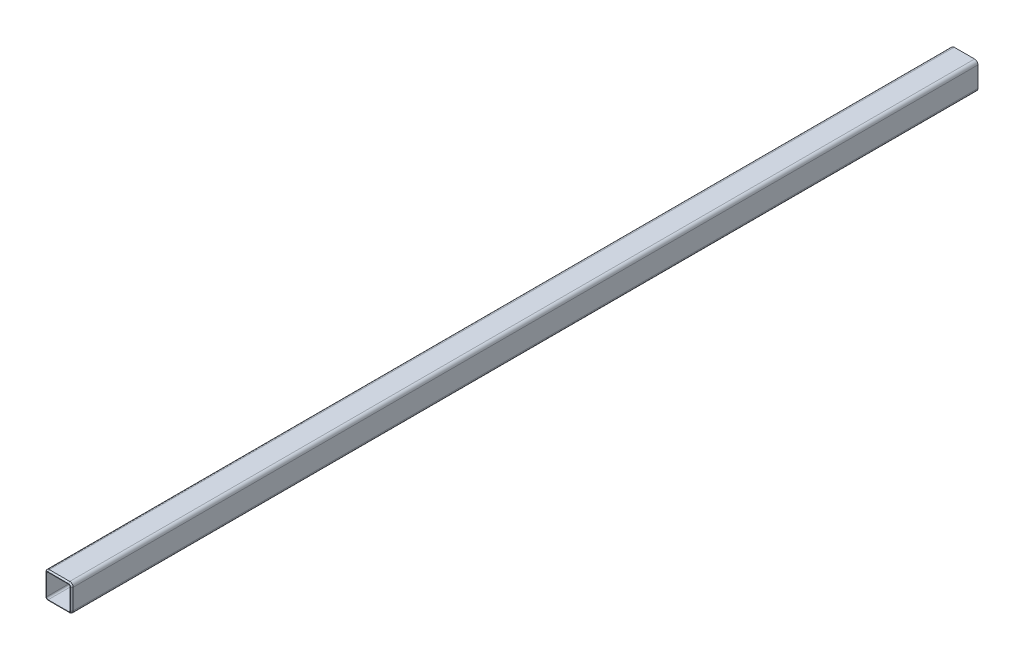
SolidWorks part; units mm, degrees
ref_plane "Front Plane" through (0, 0, 0) normal (1, 0, 0) x (0, 1, 0)
ref_plane "Top Plane" through (0, 0, 0) normal (0, 0, 1) x (0, 1, 0)
ref_plane "Right Plane" through (0, 0, 0) normal (0, 1, 0) x (-1, 0, 0)
sketch "8in beam" plane through (0, 0, 0) normal (0, 0, 1) x (0, 1, 0)
  line B0 (-76.2, -88.9) -> (76.2, -88.9)
  line B1 (-88.9, -76.2) -> (-88.9, 76.2)
  line B2 (76.2, 88.9) -> (-76.2, 88.9)
  line B3 (88.9, 76.2) -> (88.9, -76.2)
  line B4 (-76.2, -101.6) -> (76.2, -101.6)
  line B5 (-101.6, -76.2) -> (-101.6, 76.2)
  line B6 (76.2, 101.6) -> (-76.2, 101.6)
  line B7 (101.6, 76.2) -> (101.6, -76.2)
  arc B8 (101.6, 76.2) -> (76.2, 101.6) centre (76.2, 76.2) ccw
  arc B9 (76.2, -101.6) -> (101.6, -76.2) centre (76.2, -76.2) ccw
  arc B10 (-101.6, -76.2) -> (-76.2, -101.6) centre (-76.2, -76.2) ccw
  arc B11 (-76.2, 101.6) -> (-101.6, 76.2) centre (-76.2, 76.2) ccw
  arc B12 (-76.2, 88.9) -> (-88.9, 76.2) centre (-76.2, 76.2) ccw
  arc B13 (88.9, 76.2) -> (76.2, 88.9) centre (76.2, 76.2) ccw
  arc B14 (76.2, -88.9) -> (88.9, -76.2) centre (76.2, -76.2) ccw
  arc B15 (-88.9, -76.2) -> (-76.2, -88.9) centre (-76.2, -76.2) ccw
  line B16 (-76.2, 76.2) -> (76.2, -76.2) construction
sketch_block_instance "8x8x0.5-1"
sketch_block "8x8x0.5" parameters "D1"=25.4, "D2"=12.7, "D3"=12.7, "D4"=12.7, "D5"=203.2, "D6"=203.2, "D7"=177.8, "D8"=177.8, "D9"=101.6
extrude "Boss-Extrude1" add sketch "8in beam" along normal blind 6680.93 and the other way blind 101.6
chamfer "Chamfer1" distance 9.525 angle 45 8 edges at (94.1605, 94.1605, 6680.93) (0, 101.6, 6680.93) (-94.1605, 94.1605, 6680.93) (-101.6, 0, 6680.93) (-94.1605, -94.1605, 6680.93) (0, -101.6, 6680.93) (94.1605, -94.1605, 6680.93) (101.6, 0, 6680.93)
